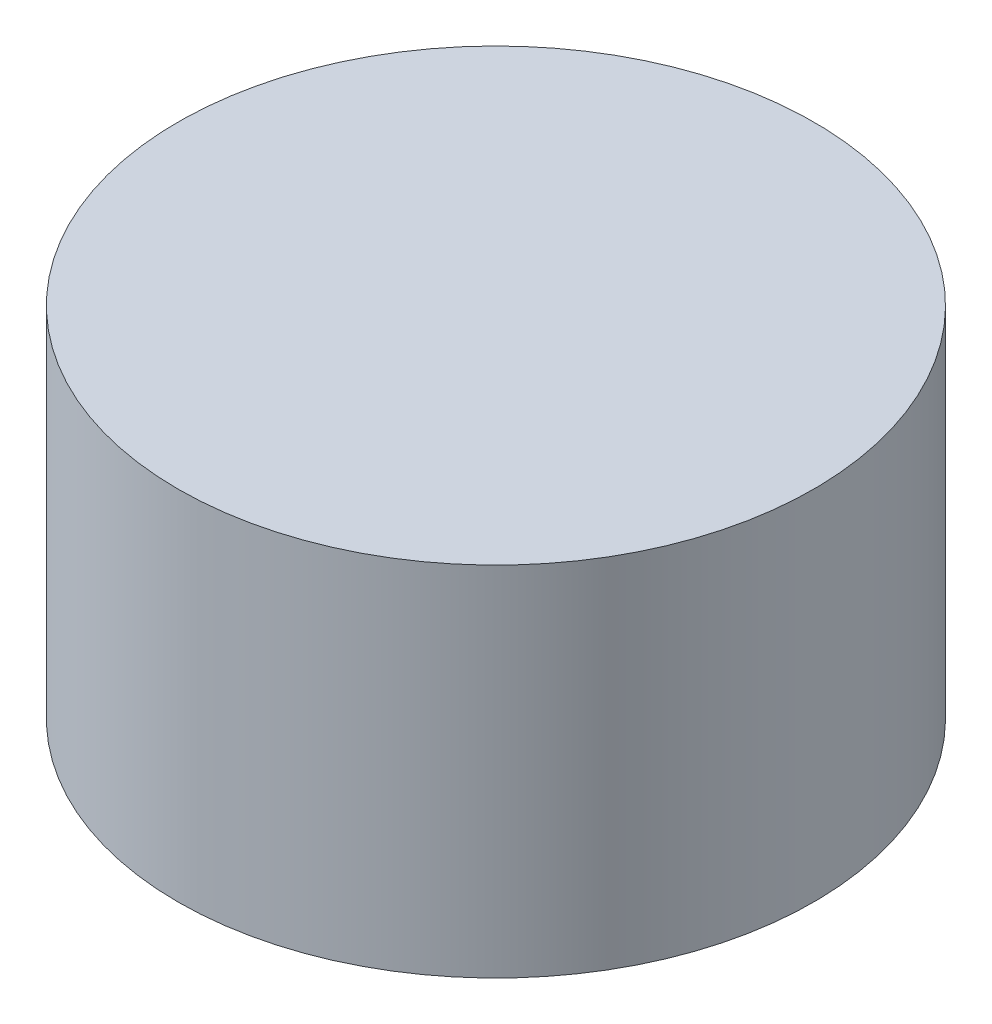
SolidWorks part; units mm, degrees
ref_plane "Front Plane" through (0, 0, 0) normal (0, 0, 1) x (1, 0, 0)
ref_plane "Top Plane" through (0, 0, 0) normal (0, 1, 0) x (1, 0, 0)
ref_plane "Right Plane" through (0, 0, 0) normal (1, 0, 0) x (0, 0, -1)
sketch "Sketch1" plane through (0, 0, 0) normal (0, 1, 0) x (1, 0, 0)
  circle A0 centre (0, 0) radius 4.064
  dimension "D1" = 8.128
extrude "Boss-Extrude1" add sketch "Sketch1" along normal mid plane 4.572
